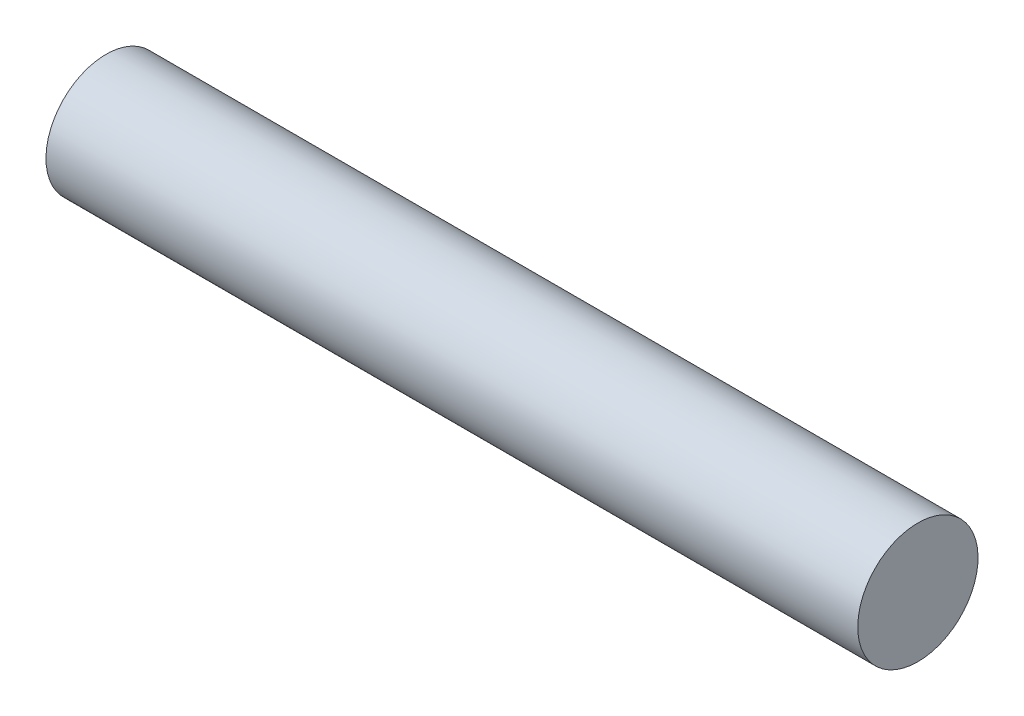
SolidWorks part; units mm, degrees
ref_plane "Front Plane" through (0, 0, 0) normal (0, 0, 1) x (1, 0, 0)
ref_plane "Top Plane" through (0, 0, 0) normal (0, 1, 0) x (1, 0, 0)
ref_plane "Right Plane" through (0, 0, 0) normal (1, 0, 0) x (0, 0, -1)
sketch "Sketch1" plane through (0, 0, 0) normal (0, 0, 1) x (1, 0, 0)
  line L0 (0, 0) -> (0, 2)
  line L1 (0, 2) -> (27, 2)
  line L2 (27, 2) -> (27, 0)
  line L3 (27, 0) -> (0, 0)
  line L4 (27, 0) -> (0, 0) construction
  dimension "D1" = 27
  dimension "D2" = 2
revolve "Revolve1" add sketch "Sketch1" angle 360 about L4
